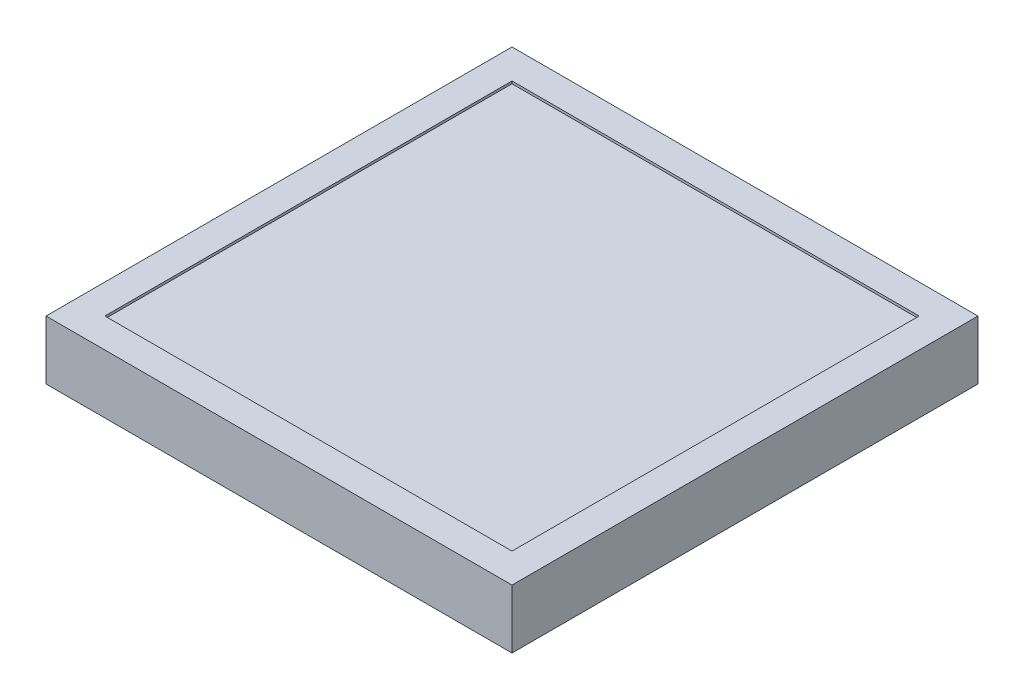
SolidWorks part; units mm, degrees
ref_plane "Alzado" through (0, 0, 0) normal (0, 0, 1) x (1, 0, 0)
ref_plane "Planta" through (0, 0, 0) normal (0, 1, 0) x (1, 0, 0)
ref_plane "Vista lateral" through (0, 0, 0) normal (1, 0, 0) x (0, 0, -1)
sketch "Croquis1" plane through (0, 0, 0) normal (0, 1, 0) x (1, 0, 0)
  line L1 (-45.8565, -145.2549) -> (144.1435, -145.2549)
  line L2 (-45.8565, -145.2549) -> (-45.8565, 44.7451)
  line L3 (-45.8565, 44.7451) -> (144.1435, 44.7451)
  line L4 (144.1435, -145.2549) -> (144.1435, 44.7451)
  line L5 (-45.8565, -145.2549) -> (144.1435, 44.7451) construction
  line L6 (-45.8565, 44.7451) -> (144.1435, -145.2549) construction
  dimension "D1" = 190
  dimension "D2" = 190
extrude "Saliente-Extruir1" add sketch "Croquis1" along normal blind 24
sketch "Croquis3" plane through (0, 24, 0) normal (0, 1, 0) x (1, 0, 0)
  line L0 (144.1435, -145.2549) -> (144.1435, 44.7451) construction
  line L1 (-33.8565, -133.2549) -> (132.1435, -133.2549)
  line L2 (-33.8565, -133.2549) -> (-33.8565, 32.7451)
  line L3 (-33.8565, 32.7451) -> (132.1435, 32.7451)
  line L4 (132.1435, -133.2549) -> (132.1435, 32.7451)
  line L5 (-33.8565, -133.2549) -> (132.1435, 32.7451) construction
  line L6 (-33.8565, 32.7451) -> (132.1435, -133.2549) construction
  line L7 (144.1435, 44.7451) -> (-45.8565, 44.7451) construction
  line L8 (-45.8565, 44.7451) -> (-45.8565, -145.2549) construction
  line L9 (-45.8565, -145.2549) -> (144.1435, -145.2549) construction
  point P0 (49.1435, -50.2549)
  dimension "D1" = 12
  dimension "D2" = 12
  dimension "D3" = 12
  dimension "D4" = 12
extrude "Cortar-Extruir2" cut sketch "Croquis3" against normal blind 1
